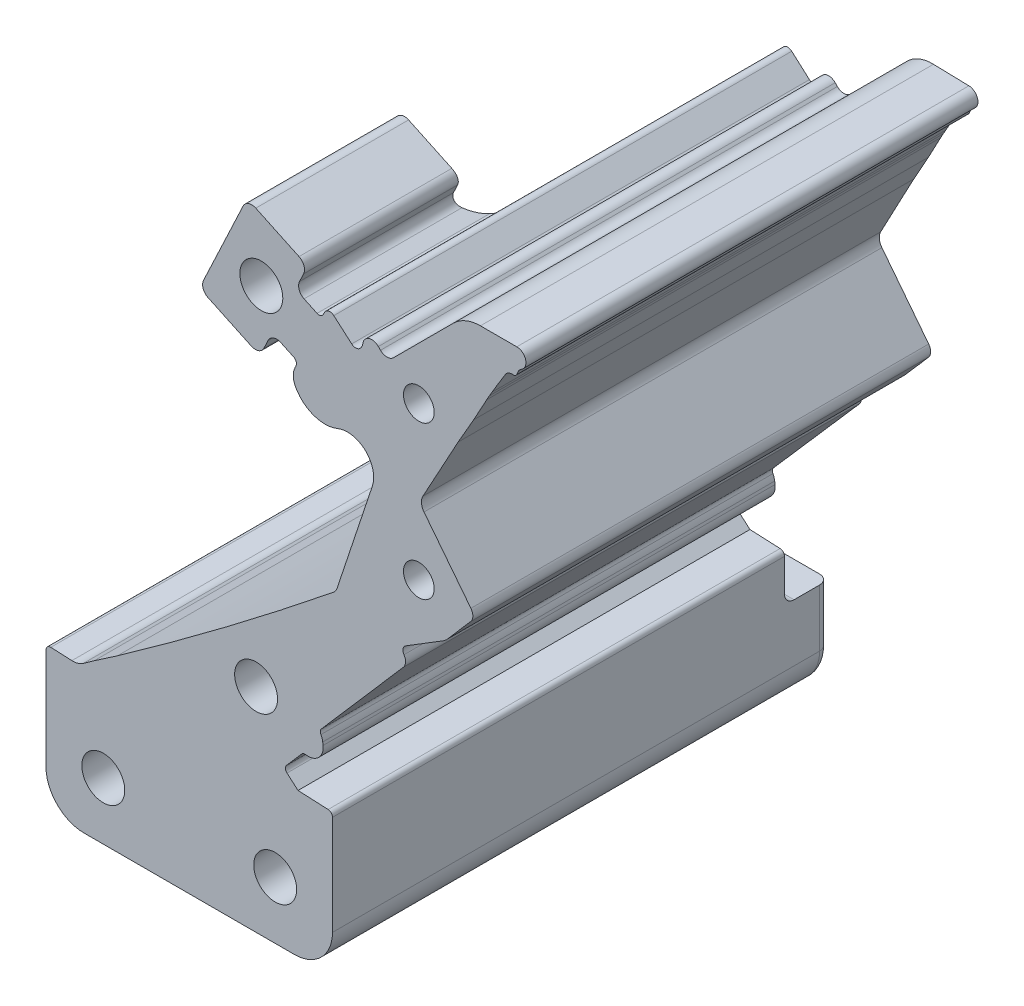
SolidWorks part; units mm, degrees
other "<24051_Punch26[Mounted in the strip]>-<Fillet12>"
ref_plane "Front" through (0, 0, 0) normal (0, 0, 1) x (1, 0, 0)
ref_plane "Top" through (0, 0, 0) normal (0, 1, 0) x (1, 0, 0)
ref_plane "Right" through (0, 0, 0) normal (1, 0, 0) x (0, 0, -1)
inserted part "24051_Punch26[Mounted in the strip]1"
hole_wizard "Hole1" positions "Point_Sketch" profile "Profil_Sketch" legacy
sketch "Point_Sketch" plane through (-251.3751, -9.86, 71.9582) normal (0, 0, -1) x (1, 0, 0)
  point P0 (12.8691, 0.935)
  point P2 (12.8691, 26.335)
sketch "Profil_Sketch" plane through (-238.506, -10.795, 71.9582) normal (1, 0, 0) x (0, -1, 0)
  line L0 (0, 0) -> (0, 83.2749)
  line L1 (0, 83.2749) -> (1.2065, 82.55)
  line L2 (1.2065, 82.55) -> (1.2065, 41.275)
  line L3 (1.2065, 41.275) -> (2.5527, 41.275)
  line L4 (2.5527, 0) -> (0, 0)
  line L5 (0, -11.3109) -> (0, 121.1557) construction
  line L6 (0, 83.2749) -> (-1.2065, 82.55) construction
  line L7 (2.5527, 41.275) -> (2.5527, 0)
  dimension "Depth" = 82.55
  dimension "Drill Angle" = 118
  dimension "Diameter" = 2.413
  dimension "L1" = 41.275
other "usin_TR460<1>"
hole_wizard "Hole11" positions "Point_Sketch1" profile "Profil_Sketch1" counterbore size "1/4" standard "ANSI Inch"
sketch "Point_Sketch1" plane through (-252.6879, -64.1525, -4.2418) normal (0, 0, 1) x (-1, 0, 0)
  point P0 (12.8691, 0.935)
  point P2 (38.2691, 26.7795)
  point P4 (9.6941, 26.7795)
sketch "Profil_Sketch1" plane through (-265.557, -65.0875, -4.2418) normal (1, 0, 0) x (0, 1, 0)
  line L0 (0, 0) -> (0, 76.2)
  line L1 (0, 76.2) -> (3.5687, 76.2)
  line L3 (3.5687, 76.2) -> (3.5687, 22.352)
  line L4 (3.5687, 22.352) -> (5.3594, 22.352)
  line L5 (5.3594, 22.352) -> (5.3594, 0)
  line L7 (5.3594, 0) -> (0, 0)
  line L11 (0, -6.35) -> (0, 107.95) construction
  dimension "Diameter" = 7.1374
  dimension "Thru Hole Depth" = 76.2
  dimension "L1" = 22.352
other "usin_LS160_.25-20x3-SHCS<1>"
sketch "Sketch3" plane through (0, 0, -4.2418) normal (0, 0, 1) x (1, 0, 0)
  circle A1 centre (-290.957, -90.932) radius 5.3594
  circle A2 centre (-290.957, -90.932) radius 5.3594
  circle A3 centre (-262.382, -90.932) radius 5.3594
  circle A4 centre (-262.382, -90.932) radius 5.3594
  dimension "D1" = 0
  dimension "D2" = 0
extrude "Cut-Extrude1" cut sketch "Sketch3" against normal through all
hole_wizard "Hole12" positions "Point_Sketch2" profile "Profil_Sketch2" counterbore size "1/4" standard "ANSI Inch"
sketch "Point_Sketch2" plane through (-251.8192, -6.0108, 46.5582) normal (0, 0, 1) x (-1, 0, 0)
  point P0 (12.8691, 0.935)
sketch "Profil_Sketch2" plane through (-264.6883, -6.9458, 46.5582) normal (1, 0, 0) x (0, 1, 0)
  line L0 (0, 0) -> (0, 25.4)
  line L1 (0, 25.4) -> (3.5687, 25.4)
  line L3 (3.5687, 25.4) -> (3.5687, 9.652)
  line L4 (3.5687, 9.652) -> (5.3594, 9.652)
  line L5 (5.3594, 9.652) -> (5.3594, 0)
  line L7 (5.3594, 0) -> (0, 0)
  line L11 (0, -6.35) -> (0, 107.95) construction
  dimension "Diameter" = 7.1374
  dimension "Thru Hole Depth" = 25.4
  dimension "L1" = 9.652
other "usin_LS160_.25-20x1.5-SHCS<2>"
sketch "Sketch6" plane through (0, 0, 46.5582) normal (0, 0, 1) x (1, 0, 0)
  line L1 (-260.3807, -3.7571) -> (-264.3994, -12.2974)
  line L2 (-260.3807, -3.7571) -> (-264.3994, -12.2974)
  arc A1 (-264.3994, -12.2974) -> (-260.3807, -3.7571) centre (-264.6883, -6.9458) ccw
  arc A2 (-264.3994, -12.2974) -> (-260.3807, -3.7571) centre (-264.6883, -6.9458) ccw
  dimension "D1" = 0
extrude "Cut-Extrude2" cut sketch "Sketch6" against normal through all
sketch "Sketch7" plane through (0, 0, -4.2418) normal (0, 0, -1) x (-1, 0, 0)
  line L0 (231.0513, -36.8875) -> (253.2954, -5.9625) construction
  line L1 (232.4947, -37.9258) -> (254.7388, -7.0008) construction
  line L2 (232.4947, -37.9258) -> (231.0513, -36.8875) construction
  point P6 (243.6167, -22.4633)
  dimension "D1" = 1.778
ref_plane "Plane1" through (-243.6167, -22.4633, -4.2418) normal (-0.5839, 0.8118, 0) x (0.8118, 0.5839, 0)
sketch "Sketch8" plane through (-243.6167, -22.4633, -4.2418) normal (-0.5839, 0.8118, 0) x (0.8118, 0.5839, 0)
  line L0 (3.3008, 0) -> (3.9263, 0)
  line L1 (3.3008, 0) -> (3.9263, 0) construction
  line L2 (3.9263, 0) -> (14.9296, 0)
  line L3 (3.9263, 0) -> (14.9296, 0) construction
  line L4 (14.9296, 0) -> (19.6518, 0)
  line L5 (14.9296, 0) -> (19.6518, 0) construction
  line L6 (19.6518, 0) -> (23.7326, 0)
  line L7 (19.6518, 0) -> (23.7326, 0) construction
  line L8 (23.7326, 0) -> (24.538, 0)
  line L9 (23.7326, 0) -> (24.538, 0) construction
  line L10 (24.538, 0) -> (25.3528, 0)
  line L11 (24.538, 0) -> (25.3528, 0) construction
  line L12 (25.3528, 0) -> (29.37, 0)
  line L13 (25.3528, 0) -> (29.37, 0) construction
  line L14 (29.37, 0) -> (29.868, 0)
  line L15 (29.37, 0) -> (29.868, 0) construction
  line L16 (29.868, 0) -> (30.7001, 0)
  line L17 (29.868, 0) -> (30.7001, 0) construction
  line L18 (30.7001, 0) -> (31.3793, 0)
  line L19 (30.7001, 0) -> (31.3793, 0) construction
  line L20 (31.3793, 0) -> (31.8173, 0)
  line L21 (31.3793, 0) -> (31.8173, 0) construction
  line L22 (31.8173, 0) -> (32.6977, 0)
  line L23 (31.8173, 0) -> (32.6977, 0) construction
  line L24 (32.6977, 0) -> (34.3365, 0)
  line L25 (32.6977, 0) -> (34.3365, 0) construction
  line L26 (34.3365, 0) -> (34.3365, -76.2)
  line L27 (34.3365, 0) -> (34.3365, -76.2) construction
  line L28 (34.3365, -76.2) -> (32.6977, -76.2)
  line L29 (34.3365, -76.2) -> (32.6977, -76.2) construction
  line L30 (32.6977, -76.2) -> (31.8173, -76.2)
  line L31 (32.6977, -76.2) -> (31.8173, -76.2) construction
  line L32 (31.8173, -76.2) -> (31.3793, -76.2)
  line L33 (31.8173, -76.2) -> (31.3793, -76.2) construction
  line L34 (31.3793, -76.2) -> (30.7001, -76.2)
  line L35 (31.3793, -76.2) -> (30.7001, -76.2) construction
  line L36 (30.7001, -76.2) -> (29.868, -76.2)
  line L37 (30.7001, -76.2) -> (29.868, -76.2) construction
  line L38 (29.868, -76.2) -> (29.37, -76.2)
  line L39 (29.868, -76.2) -> (29.37, -76.2) construction
  line L40 (29.37, -76.2) -> (25.3528, -76.2)
  line L41 (29.37, -76.2) -> (25.3528, -76.2) construction
  line L42 (25.3528, -76.2) -> (24.538, -76.2)
  line L43 (25.3528, -76.2) -> (24.538, -76.2) construction
  line L44 (24.538, -76.2) -> (23.7326, -76.2)
  line L45 (24.538, -76.2) -> (23.7326, -76.2) construction
  line L46 (23.7326, -76.2) -> (19.6518, -76.2)
  line L47 (23.7326, -76.2) -> (19.6518, -76.2) construction
  line L48 (19.6518, -76.2) -> (14.9296, -76.2)
  line L49 (19.6518, -76.2) -> (14.9296, -76.2) construction
  line L50 (14.9296, -76.2) -> (3.9263, -76.2)
  line L51 (14.9296, -76.2) -> (3.9263, -76.2) construction
  line L52 (3.9263, -76.2) -> (3.3008, -76.2)
  line L53 (3.9263, -76.2) -> (3.3008, -76.2) construction
  line L54 (3.3008, -76.2) -> (2.1286, -76.2)
  line L55 (3.3008, -76.2) -> (2.1286, -76.2) construction
  line L56 (2.1286, -76.2) -> (-3.5951, -76.2)
  line L57 (2.1286, -76.2) -> (-3.5951, -76.2) construction
  line L58 (-3.5951, -76.2) -> (-4.55, -76.2)
  line L59 (-3.5951, -76.2) -> (-4.55, -76.2) construction
  line L60 (-4.55, -76.2) -> (-11.7938, -76.2)
  line L61 (-4.55, -76.2) -> (-11.7938, -76.2) construction
  line L62 (-11.7938, -76.2) -> (-12.8813, -76.2)
  line L63 (-11.7938, -76.2) -> (-12.8813, -76.2) construction
  line L64 (-12.8813, -76.2) -> (-14.0541, -76.2)
  line L65 (-12.8813, -76.2) -> (-14.0541, -76.2) construction
  line L66 (-14.0541, -76.2) -> (-34.252, -76.2)
  line L67 (-14.0541, -76.2) -> (-34.252, -76.2) construction
  line L68 (-34.252, -76.2) -> (-34.8337, -76.2)
  line L69 (-34.252, -76.2) -> (-34.8337, -76.2) construction
  line L70 (-34.8337, -76.2) -> (-35.1269, -76.2)
  line L71 (-34.8337, -76.2) -> (-35.1269, -76.2) construction
  line L72 (-35.1269, -76.2) -> (-35.3559, -76.2)
  line L73 (-35.1269, -76.2) -> (-35.3559, -76.2) construction
  line L74 (-35.3559, -76.2) -> (-39.3088, -76.2)
  line L75 (-35.3559, -76.2) -> (-39.3088, -76.2) construction
  line L76 (-39.3088, -76.2) -> (-39.5188, -76.2)
  line L77 (-39.3088, -76.2) -> (-39.5188, -76.2) construction
  line L78 (-39.5188, -76.2) -> (-39.6619, -76.2)
  line L79 (-39.5188, -76.2) -> (-39.6619, -76.2) construction
  line L80 (-39.6619, -76.2) -> (-49.336, -76.2)
  line L81 (-39.6619, -76.2) -> (-49.336, -76.2) construction
  line L82 (-49.336, -76.2) -> (-58.1989, -76.2)
  line L83 (-49.336, -76.2) -> (-58.1989, -76.2) construction
  line L84 (-58.1989, -76.2) -> (-86.5512, -76.2)
  line L85 (-58.1989, -76.2) -> (-86.5512, -76.2) construction
  line L86 (-86.5512, -76.2) -> (-89.1933, -76.2)
  line L87 (-86.5512, -76.2) -> (-89.1933, -76.2) construction
  line L88 (-89.1933, -76.2) -> (-89.1933, 4.7625)
  line L89 (-89.1933, -76.2) -> (-89.1933, 4.7625) construction
  line L90 (-87.6058, 6.35) -> (-85.6242, 6.35)
  line L91 (-87.6058, 6.35) -> (-85.6242, 6.35) construction
  line L92 (-85.6242, 6.35) -> (-57.2719, 6.35)
  line L93 (-85.6242, 6.35) -> (-57.2719, 6.35) construction
  line L94 (-57.2719, 6.35) -> (-50.6247, 6.35)
  line L95 (-57.2719, 6.35) -> (-50.6247, 6.35) construction
  line L96 (-50.6247, 6.35) -> (-45.0628, 6.35)
  line L97 (-50.6247, 6.35) -> (-45.0628, 6.35) construction
  line L98 (-43.7741, 4.7625) -> (-43.7741, 1.5875)
  line L99 (-43.7741, 4.7625) -> (-43.7741, 1.5875) construction
  line L100 (-42.8471, 0) -> (-39.6619, 0)
  line L101 (-42.8471, 0) -> (-39.6619, 0) construction
  line L102 (-39.6619, 0) -> (-39.5188, 0)
  line L103 (-39.6619, 0) -> (-39.5188, 0) construction
  line L104 (-39.5188, 0) -> (-39.3088, 0)
  line L105 (-39.5188, 0) -> (-39.3088, 0) construction
  line L106 (-39.3088, 0) -> (-35.3559, 0)
  line L107 (-39.3088, 0) -> (-35.3559, 0) construction
  line L108 (-35.3559, 0) -> (-35.1269, 0)
  line L109 (-35.3559, 0) -> (-35.1269, 0) construction
  line L110 (-35.1269, 0) -> (-34.8337, 0)
  line L111 (-35.1269, 0) -> (-34.8337, 0) construction
  line L112 (-34.8337, 0) -> (-34.252, 0)
  line L113 (-34.8337, 0) -> (-34.252, 0) construction
  line L114 (-34.252, 0) -> (-14.0541, 0)
  line L115 (-34.252, 0) -> (-14.0541, 0) construction
  line L116 (-14.0541, 0) -> (-12.8813, 0)
  line L117 (-14.0541, 0) -> (-12.8813, 0) construction
  line L118 (-12.8813, 0) -> (-11.7938, 0)
  line L119 (-12.8813, 0) -> (-11.7938, 0) construction
  line L120 (-11.7938, 0) -> (-4.55, 0)
  line L121 (-11.7938, 0) -> (-4.55, 0) construction
  line L122 (-4.55, 0) -> (-3.5951, 0)
  line L123 (-4.55, 0) -> (-3.5951, 0) construction
  line L124 (-3.5951, 0) -> (2.1286, 0)
  line L125 (-3.5951, 0) -> (2.1286, 0) construction
  line L126 (2.1286, 0) -> (3.3008, 0)
  line L127 (2.1286, 0) -> (3.3008, 0) construction
  line L128 (0.0158, -0.0005) -> (34.3365, -1.0668)
  line L129 (-0.0158, -0.0005) -> (-34.3365, -1.0668)
  line L130 (0, 0) -> (0, 25.3463) construction
  line L131 (-34.3523, -1.067) -> (-42.5041, -1.067)
  line L132 (-42.5041, -1.067) -> (-42.5041, 24.0394)
  arc A0 (-87.6058, 6.35) -> (-89.1933, 4.7625) centre (-87.6058, 4.7625) ccw
  arc A1 (-87.6058, 6.35) -> (-89.1933, 4.7625) centre (-87.6058, 4.7625) ccw construction
  arc A2 (-34.3523, -1.067) -> (-34.3365, -1.0668) centre (-34.3523, -0.559) ccw
  arc A3 (0.0158, -0.0005) -> (-0.0158, -0.0005) centre (0, -0.5082) ccw
  ellipse E0 centre (-45.0628, 4.7625) end of major axis (-45.0628, 6.35) minor radius 1.2887 (-43.7741, 4.7625) -> (-45.0628, 6.35) ccw
  ellipse E1 centre (-45.0628, 4.7625) end of major axis (-45.0628, 6.35) minor radius 1.2887 (-43.7741, 4.7625) -> (-45.0628, 6.35) ccw construction
  ellipse E2 centre (-42.8471, 1.5875) end of major axis (-42.8471, 3.175) minor radius 0.927 (-43.7741, 1.5875) -> (-42.8471, 0) ccw
  ellipse E3 centre (-42.8471, 1.5875) end of major axis (-42.8471, 3.175) minor radius 0.927 (-43.7741, 1.5875) -> (-42.8471, 0) ccw construction
  dimension "D2" = 0.508
  dimension "D1" = 1.0668
  dimension "D3" = 1.27
extrude "Cut-Extrude3" cut sketch "Sketch8" against normal through all and the other way through all flip side to cut
other "DeleteFace1"
fillet "Fillet1" radius 1.5875 1 edges at (-276.6695, -84.582, -3.1748)
